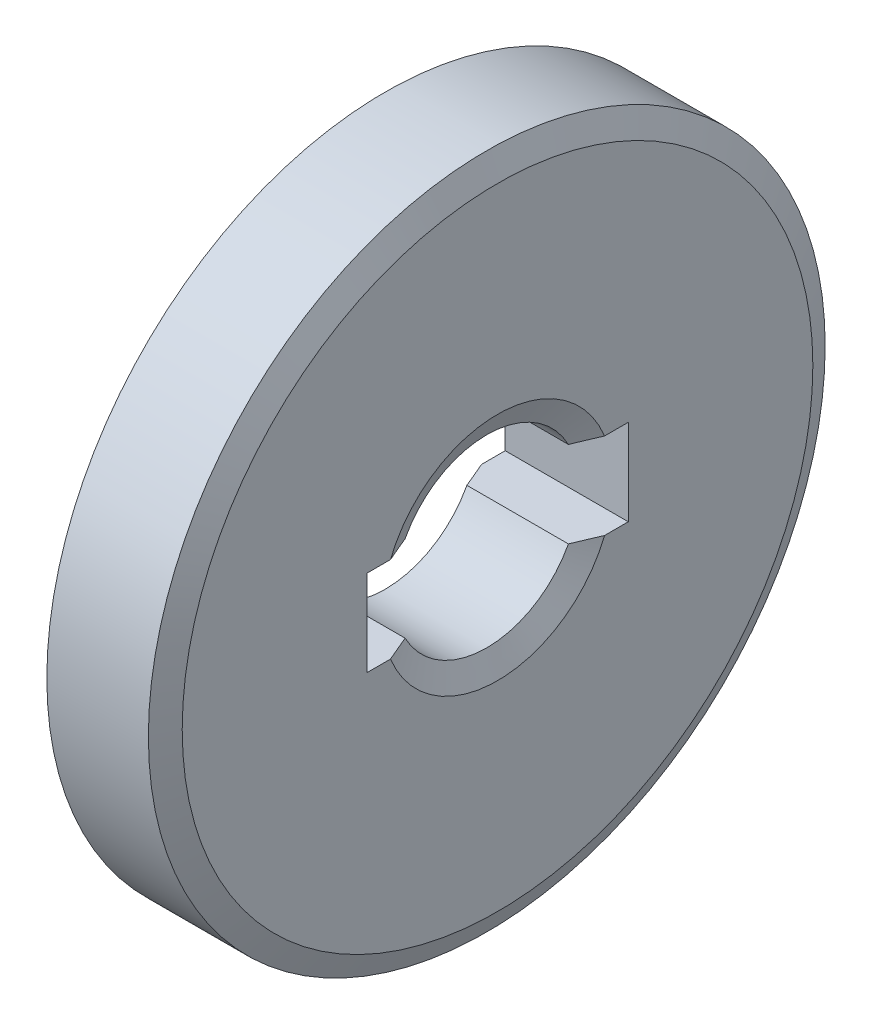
SolidWorks part; units mm, degrees
ref_plane "Plan1" through (0, 0, 0) normal (0, 0, 1) x (1, 0, 0)
ref_plane "Plan2" through (0, 0, 0) normal (0, 1, 0) x (1, 0, 0)
ref_plane "Plan3" through (0, 0, 0) normal (1, 0, 0) x (0, 0, -1)
sketch "Esquisse1" plane through (0, 0, 0) normal (0, 0, 1) x (1, 0, 0)
  line L0 (16.2377, 0) -> (-18.199, 0) construction
  line L1 (0, 11) -> (4, 11)
  line L2 (0, 11) -> (0, 3)
  line L3 (0, 3) -> (4, 3)
  line L4 (4, 11) -> (4, 3)
  dimension "D1" = 3
  dimension "D2" = 8
  dimension "D3" = 4
revolve "Base-Révolution" add sketch "Esquisse1" angle 360 about L0
chamfer "Chanfrein1" distance 0.75 angle 25
sketch "Esquisse2" plane through (4, 0, 0) normal (1, 0, 0) x (0, 0, -1)
  line L0 (0, 4.6606) -> (0, -3.5668) construction
  line L1 (6.4884, 0) -> (-7.7312, 0) construction
  line L2 (-4.25, 1.4) -> (4.25, 1.4)
  line L3 (-4.25, -1.4) -> (4.25, -1.4)
  line L4 (4.25, -1.4) -> (4.25, 1.4)
  line L5 (-4.25, -1.4) -> (-4.25, 1.4)
  point P9 (0, 1.4)
  dimension "D1" = 4.25
  dimension "D2" = 1.4
extrude "Enlèv. mat.-Extru.1" cut sketch "Esquisse2" against normal through all
